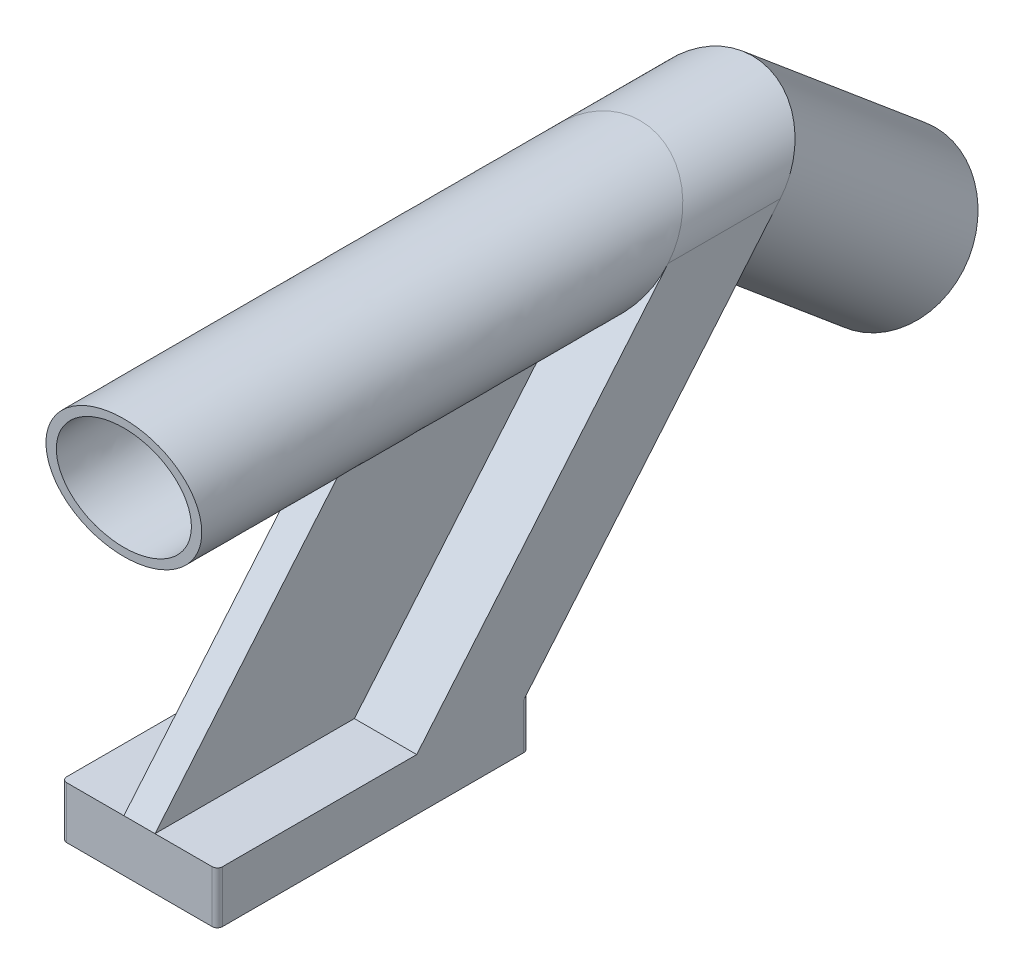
SolidWorks part; units mm, degrees
ref_plane "Ebene vorne" through (0, 0, 0) normal (0, 0, 1) x (1, 0, 0)
ref_plane "Ebene oben" through (0, 0, 0) normal (0, 1, 0) x (1, 0, 0)
ref_plane "Ebene rechts" through (0, 0, 0) normal (1, 0, 0) x (0, 0, -1)
sketch "Skizze1" plane through (0, 0, 0) normal (0, 1, 0) x (1, 0, 0)
  line L0 (0, 0) -> (32.4602, 0) construction
  line L1 (-75, 150) -> (75, 150)
  line L2 (-75, 150) -> (-75, -150)
  line L3 (-75, -150) -> (75, -150)
  line L4 (75, 150) -> (75, -150)
  line L5 (-75, 150) -> (75, -150) construction
  line L6 (-75, -150) -> (75, 150) construction
  point P0 (0, 0)
  dimension "D1" = 300
  dimension "D2" = 150
extrude "Aufsatz-Linear austragen1" add sketch "Skizze1" along normal blind 50
ref_plane "Ebene1" through (0, 0, 0) normal (0, 0.6428, 0.766) x (1, 0, 0)
sketch "Skizze2" plane through (0, 0, 0) normal (0, 0.6428, 0.766) x (1, 0, 0)
  line L0 (75, 0) -> (-75, 0)
  line L1 (-75, 0) -> (-75, 441.8841)
  line L2 (75, 441.8841) -> (75, 0)
  line L8 (75, -58.1159) -> (75, 134.7204) construction
  line L9 (-75, 134.7204) -> (-75, -58.1159) construction
  arc A0 (-75, 441.8841) -> (75, 441.8841) centre (0, 441.8841) cw
  point P6 (0, 0)
  point P11 (0, 0)
  point P12 (0, 0)
  dimension "D1" = 500
extrude "Aufsatz-Linear austragen2" add sketch "Skizze2" along direction (0, 0, -1) on the side against the normal up to vertex (82.7673 mm away)
sketch "Skizze5" plane through (0, 0, 0) normal (0, 0.6428, 0.766) x (1, 0, 0)
  arc A0 (75, 441.8841) -> (-75, 441.8841) centre (0, 441.8841) ccw construction
  circle A1 centre (0, 441.8841) radius 75
  point P3 (75, 108.3361)
extrude "Aufsatz-Linear austragen5" add sketch "Skizze5" along direction (0, 0, -1) on the side of the normal blind 500
sketch "Skizze6" plane through (0, 246.2019, 293.412) normal (0, 0.6428, 0.766) x (1, 0, 0)
  circle A2 centre (0, 120.4903) radius 65
  circle A3 centre (0, 120.4903) radius 65
  dimension "D1" = 10
extrude "Schnitt-Linear austragen1" cut sketch "Skizze6" along direction (0, 0, -1) on the side against the normal up to surface (608.045 mm away)
sketch "Skizze7" plane through (0, -53.2018, -63.4034) normal (0, -0.6428, -0.766) x (-1, 0, 0)
  arc A0 (75, 511.3341) -> (-75, 511.3341) centre (0, 511.3341) ccw construction
  circle A1 centre (0, 511.3341) radius 75
  point P3 (75, 507.5098)
extrude "Aufsatz-Linear austragen6" add sketch "Skizze7" along normal blind 230
sketch "Skizze8" plane through (0, -201.0429, -239.5936) normal (0, -0.6428, -0.766) x (-1, 0, 0)
  circle A0 centre (0, 511.3341) radius 65
  dimension "D1" = 130
extrude "Schnitt-Linear austragen2" cut sketch "Skizze8" against normal up to surface (230 mm away)
sketch "Skizze9" plane through (0, 0, 0) normal (1, 0, 0) x (0, 0, -1)
  line L0 (-150, 50) -> (-53.5697, 164.9212)
  line L1 (53.03, 63.1987) -> (-53.03, -63.1987) construction
  point P4 (0, 0)
rib "Verstärkungsrippe1" sketch "Skizze9" sketch "Skizze9" thickness 30 extrusion direction parallel to sketch draft on no parameters "D1"=30
fillet "Verrundung1" radius 5 2 edges at (-75, 25, 150) (75, 25, 150)
fillet "Verrundung2" radius 5 2 edges at (-75, 25, -150) (75, 25, -150)
ref_plane "Ebene2" through (0, 0, 300) normal (0, 0, 1) x (1, 0, 0)
sketch "Skizze11" plane through (0, 0, 300) normal (0, 0, 1) x (1, 0, 0)
  line L1 (-125.3711, 446.181) -> (104.4381, 446.181)
  line L2 (-125.3711, 446.181) -> (-125.3711, 214.7666)
  line L3 (-125.3711, 214.7666) -> (104.4381, 214.7666)
  line L4 (104.4381, 446.181) -> (104.4381, 214.7666)
  point P4 (-125.3711, 214.7666)
extrude "Schnitt-Linear austragen3" cut sketch "Skizze11" against normal blind 135
